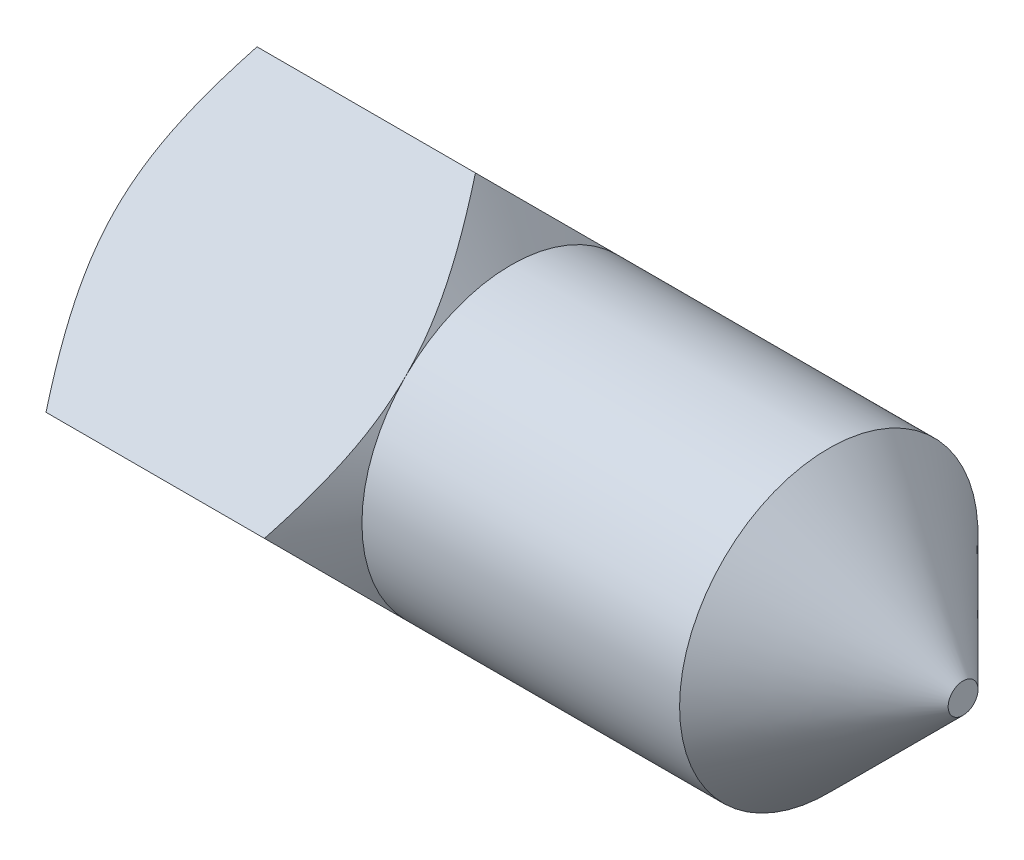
SolidWorks part; units mm, degrees
ref_plane "Front Plane" through (0, 0, 0) normal (0, 0, 1) x (1, 0, 0)
ref_plane "Top Plane" through (0, 0, 0) normal (0, 1, 0) x (1, 0, 0)
ref_plane "Right Plane" through (0, 0, 0) normal (1, 0, 0) x (0, 0, -1)
sketch "BaseHeadSke" plane through (0, 0, 0) normal (1, 0, 0) x (0, 0, -1)
  line L0 (0, 0) -> (14.1701, 0) construction
  line L1 (0, 0) -> (0, 11.9761) construction
  line L2 (0, 2.8284) -> (2.8284, 0)
  line L3 (0, -2.8284) -> (2.8284, 0)
  line L4 (0, 2.8284) -> (-2.8284, 0)
  line L5 (0, -2.8284) -> (-2.8284, 0)
  dimension "D1" = 45
  dimension "Width_flats" = 4
extrude "BaseHead" add sketch "BaseHeadSke" along normal blind 4
sketch "HeadChamferSke" plane through (0, 0, 0) normal (0, 0, 1) x (1, 0, 0)
  line L0 (0, 0) -> (6.1973, 0) construction
  line L1 (2, 2.8284) -> (2, -3.5627) construction
  line L2 (4, 2.8284) -> (0, 2.8284) construction
  line L3 (0, 2.8284) -> (0, 1.9)
  line L4 (0, 2.8284) -> (0.536, 2.8284)
  line L5 (0.536, 2.8284) -> (0, 1.9)
  line L6 (0, 2.8284) -> (0, 0) construction
  line L7 (3.464, 2.8284) -> (4, 1.9)
  line L8 (4, 2.8284) -> (3.464, 2.8284)
  line L9 (4, 2.8284) -> (4, 1.9)
  dimension "D1" = 30
  dimension "Head_chamfer" = 3.8
revolve "HeadChamfer" cut sketch "HeadChamferSke" angle 360 about L0
sketch "BodySke" plane through (0, 0, 0) normal (0, 0, 1) x (1, 0, 0)
  line L0 (0, 0) -> (13.1857, 0) construction
  line L1 (4, -1.9) -> (4, 1.9) construction
  line L2 (4, 0) -> (4, 1.9) construction
  line L3 (3.464, 2) -> (10, 2)
  line L4 (10, 2) -> (10, 0)
  line L5 (4, 1.9) -> (4, 2) construction
  line L6 (3.464, 2) -> (3.464, 0)
  line L7 (3.464, 0) -> (10, 0)
  line L8 (9.3, -3.7301) -> (9.3, 4.8101) construction
  point P9 (3.464, 1.61)
  dimension "Diameter" = 4
  dimension "Length" = 6
  dimension "Minor_dia" = 3.22
  dimension "Advance" = 0.7
revolve "BaseBody" add sketch "BodySke" angle 360 about L0
sketch "ChamferEndSke" plane through (0, 0, 0) normal (0, 0, 1) x (1, 0, 0)
  line L0 (0, 0) -> (11.9528, 0) construction
  line L1 (10, 2) -> (10, 0.2)
  line L2 (10, 0.2) -> (8.2, 2)
  line L3 (8.2, 2) -> (10, 2)
  line L4 (10, 2) -> (3.9423, 2) construction
  line L5 (10, -2) -> (10, 2) construction
  dimension "D1" = 45
  dimension "End_chamfer" = 0.4
revolve "ChamferEnd" cut sketch "ChamferEndSke" angle 360 about L0
sketch "ThdSchSke" plane through (0, 0, 0) normal (0, 0, 1) x (1, 0, 0)
  line L0 (7.5, 2.4503) -> (7.5, 2)
  line L1 (7.5, 2.4503) -> (7.9503, 2.4503)
  line L2 (7.9503, 2.4503) -> (7.9503, 2)
  line L3 (7.9503, 2) -> (7.7252, 1.61)
  line L4 (7.7252, 1.61) -> (7.5, 2)
  line L5 (0, 0) -> (11.8711, 0) construction
  line L6 (8.2, 2) -> (3.9423, 2) construction
  dimension "D1" = 0.7
revolve "ThreadSchematic" [suppressed] cut sketch "ThdSchSke" angle 360 about L5
pattern_linear "ThdSchPat" [suppressed] count 5
equation "\"D2@ThreadCosmetic\" = \"Minor_dia@BodySke\""
equation "\"D1@ThdSchSke\" = \"Advance@BodySke\""
equation "\"Advance@ThdSchPat\" = \"Advance@BodySke\""
equation "\"D1@ThdSchPat\" =  int( (  \"Length@BodySke\"  -  ( \"Diameter@BodySke\" - \"End_chamfer@ChamferEndSke\" )  / 2  )  / \"Advance@ThdSchPat\" ) - 1"
